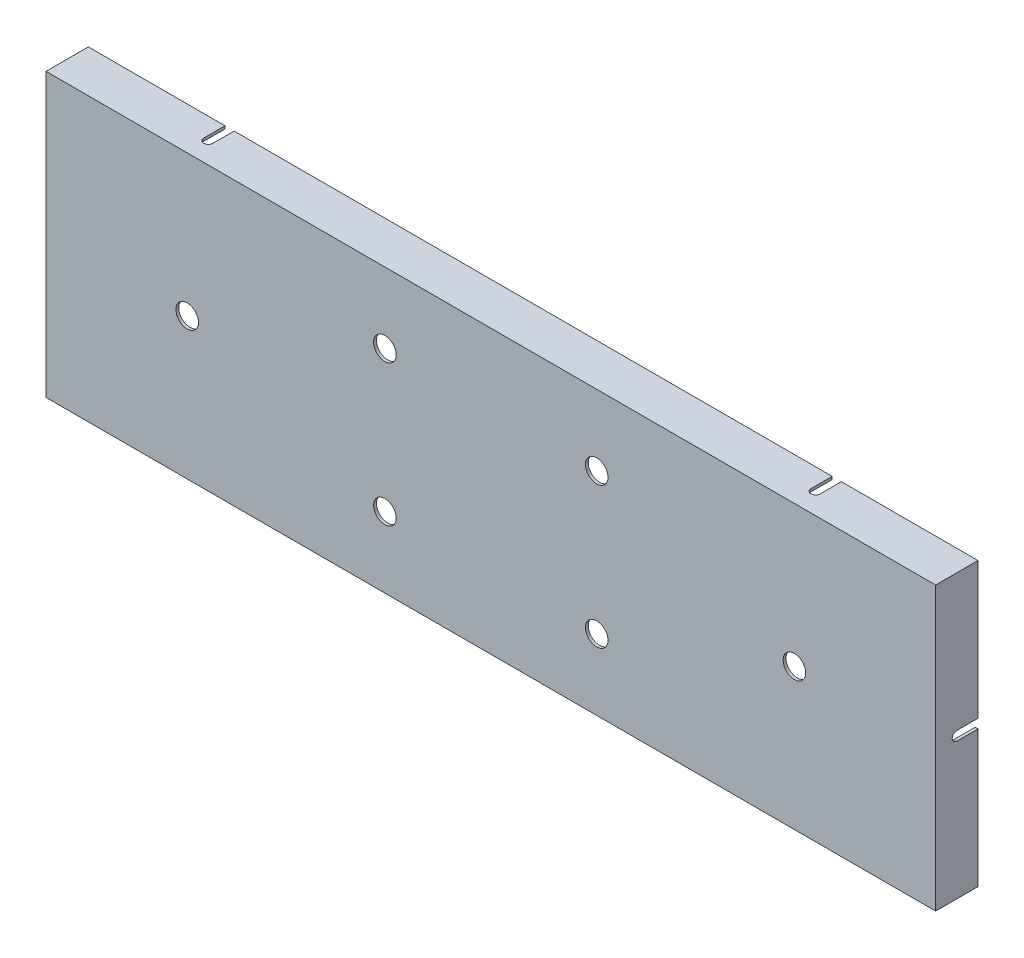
SolidWorks part; units mm, degrees
ref_plane "前基準面" through (0, 0, 0) normal (0, 0, 1) x (1, 0, 0)
ref_plane "上基準面" through (0, 0, 0) normal (0, 1, 0) x (1, 0, 0)
ref_plane "右基準面" through (0, 0, 0) normal (1, 0, 0) x (0, 0, -1)
sketch "草圖1" plane through (0, 0, 0) normal (0, 0, 1) x (1, 0, 0)
  line L1 (0, 0) -> (630, 0)
  line L2 (0, 0) -> (0, -200)
  line L3 (0, -200) -> (630, -200)
  line L4 (630, 0) -> (630, -200)
  dimension "D1" = 630
  dimension "D2" = 200
extrude "填料-伸長1" add sketch "草圖1" along normal blind 30
shell "薄殼2" thickness 2
sketch "草圖4" plane through (0, 0, 30) normal (0, 0, 1) x (1, 0, 0)
  line L0 (0, -200) -> (630, -200) construction
  line L1 (630, -200) -> (630, 0) construction
  circle A0 centre (530, -100) radius 8
  circle A1 centre (100, -100) radius 8
  circle A2 centre (240, -50) radius 8
  circle A3 centre (390, -50) radius 8
  circle A4 centre (240, -150) radius 8
  circle A5 centre (390, -150) radius 8
  dimension "D1" = 16
  dimension "D4" = 16
  dimension "D6" = 16
  dimension "D7" = 16
  dimension "D8" = 16
  dimension "D9" = 16
  dimension "D2" = 100
  dimension "D3" = 100
  dimension "D5" = 430
  dimension "D10" = 100
  dimension "D11" = 100
  dimension "D12" = 140
  dimension "D13" = 150
  dimension "D15" = 50
extrude "除料-伸長1" cut sketch "草圖4" against normal up to next
sketch "草圖5" plane through (0, 0, 0) normal (0, 1, 0) x (1, 0, 0)
  line L0 (100, 0) -> (100, -15) construction
  line L1 (630, 0) -> (0, 0) construction
  line L2 (103.25, 0) -> (103.25, -15)
  line L3 (96.75, 0) -> (96.75, -15)
  line L4 (530, 0) -> (530, -15) construction
  line L5 (533.25, 0) -> (533.25, -15)
  line L6 (526.75, 0) -> (526.75, -15)
  line L7 (0, -30) -> (0, 0) construction
  line L8 (630, -30) -> (630, 0) construction
  arc A0 (103.25, 0) -> (96.75, 0) centre (100, 0) ccw
  arc A1 (96.75, -15) -> (103.25, -15) centre (100, -15) ccw
  arc A2 (533.25, 0) -> (526.75, 0) centre (530, 0) ccw
  arc A3 (526.75, -15) -> (533.25, -15) centre (530, -15) ccw
  point P4 (100, -7.5)
  point P9 (530, -7.5)
  dimension "D1" = 3.25
  dimension "D2" = 3.25
  dimension "D3" = 15
  dimension "D4" = 15
  dimension "D5" = 100
  dimension "D6" = 100
extrude "除料-伸長2" cut sketch "草圖5" against normal through all
sketch "草圖6" plane through (0, 0, 0) normal (-1, 0, 0) x (0, 0, 1)
  line L0 (0, -100) -> (15, -100) construction
  line L1 (0, 0) -> (0, -200) construction
  line L2 (0, -96.75) -> (15, -96.75)
  line L3 (0, -103.25) -> (15, -103.25)
  arc A0 (0, -96.75) -> (0, -103.25) centre (0, -100) ccw
  arc A1 (15, -103.25) -> (15, -96.75) centre (15, -100) ccw
  point P4 (7.5, -100)
  dimension "D2" = 3.25
  dimension "D1" = 15
extrude "除料-伸長3" cut sketch "草圖6" against normal through all
